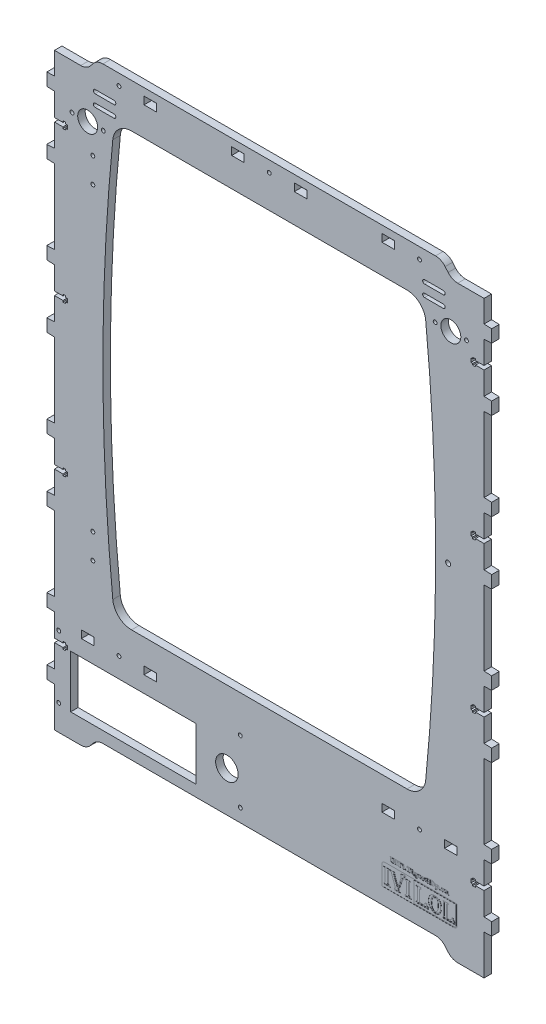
SolidWorks part; units mm, degrees
ref_plane "Спереди" through (0, 0, 0) normal (0, 0, 1) x (1, 0, 0)
ref_plane "Сверху" through (0, 0, 0) normal (0, 1, 0) x (1, 0, 0)
ref_plane "Справа" through (0, 0, 0) normal (1, 0, 0) x (0, 0, -1)
sketch "Эскиз1" plane through (0, 0, 0) normal (0, 0, 1) x (1, 0, 0)
  line L0 (161, 62) -> (177.8027, 62) construction
  line L1 (0, 77) -> (151.5411, 77) construction
  line L2 (132.5, 434) -> (157.5, 434) construction
  line L3 (90, 80.05) -> (100, 80.05)
  line L4 (100, 73.95) -> (90, 73.95)
  line L5 (90, 73.95) -> (90, 80.05)
  line L6 (100, 80.05) -> (100, 73.95)
  line L7 (140, 80.05) -> (150, 80.05)
  line L8 (150, 73.95) -> (140, 73.95)
  line L9 (140, 73.95) -> (140, 80.05)
  line L10 (150, 80.05) -> (150, 73.95)
  line L11 (-110, 445) -> (110, 445)
  line L12 (177.6, 37) -> (162.5, 37) construction
  line L13 (171.5, 92.25) -> (177.6, 92)
  line L14 (177.6, 82) -> (171.5, 81.75)
  line L15 (177.6, 92) -> (177.6, 82)
  line L16 (162.5, 63.55) -> (161, 63.55)
  line L17 (162.5, 64.75) -> (162.5, 63.55)
  line L18 (164.7, 64.75) -> (162.5, 64.75)
  line L19 (164.7, 63.55) -> (164.7, 64.75)
  line L20 (100, 468.05) -> (90, 468.05)
  line L21 (90, 468.05) -> (90, 474.15)
  line L22 (90, 474.15) -> (100, 474.15)
  line L23 (100, 474.15) -> (100, 468.05)
  line L24 (-20, 474.15) -> (-30, 474.15)
  line L25 (20, 474.15) -> (30, 474.15)
  line L26 (20, 474.15) -> (20, 468.05)
  line L27 (20, 468.05) -> (30, 468.05)
  line L32 (171.5, 63.55) -> (164.7, 63.55)
  line L33 (171.5, 81.75) -> (171.5, 63.55)
  line L34 (171.5, 212.25) -> (177.6, 212)
  line L35 (0, 471.1) -> (120, 471.1) construction
  line L36 (-150.5, 0) -> (-171.5, 0)
  line L37 (-140.4433, 6.4279) -> (-142.8396, 3.5721)
  line L38 (-177.6, 42) -> (-171.5, 42.25)
  line L39 (-177.6, 32) -> (-177.6, 42)
  line L40 (-132.7829, 10) -> (132.7829, 10)
  line L41 (140.4433, 6.4279) -> (142.8396, 3.5721)
  line L42 (150.5, 0) -> (171.5, 0)
  line L43 (171.5, 0) -> (171.5, 31.75)
  line L44 (171.5, 31.75) -> (177.6, 32)
  line L45 (177.6, 32) -> (177.6, 42)
  line L46 (177.6, 42) -> (171.5, 42.25)
  line L47 (171.5, 42.25) -> (171.5, 60.45)
  line L48 (171.5, 60.45) -> (164.7, 60.45)
  line L49 (164.7, 60.45) -> (164.7, 59.25)
  line L50 (164.7, 59.25) -> (162.5, 59.25)
  line L51 (162.5, 59.25) -> (162.5, 60.45)
  line L52 (162.5, 60.45) -> (161, 60.45)
  line L53 (161, 60.45) -> (161, 63.55)
  line L54 (-171.5, 31.75) -> (-177.6, 32)
  line L55 (-171.5, 0) -> (-171.5, 31.75)
  line L56 (-171.5, 42.25) -> (-171.5, 60.45)
  line L57 (-162.5, 60.45) -> (-161, 60.45)
  line L58 (-162.5, 59.25) -> (-162.5, 60.45)
  line L59 (-164.7, 59.25) -> (-162.5, 59.25)
  line L60 (177.6, 212) -> (177.6, 202)
  line L61 (-177.6, 442) -> (-171.5, 441.75)
  line L62 (-171.5, 470) -> (-171.5, 452.25)
  line L63 (177.6, 202) -> (171.5, 201.75)
  line L64 (171.5, 201.75) -> (171.5, 183.55)
  line L65 (171.5, 183.55) -> (164.7, 183.55)
  line L66 (164.7, 184.75) -> (162.5, 184.75)
  line L67 (171.5, 180.45) -> (164.7, 180.45)
  line L68 (171.5, 162.25) -> (171.5, 180.45)
  line L69 (177.6, 162) -> (171.5, 162.25)
  line L70 (177.6, 152) -> (177.6, 162)
  line L71 (171.5, 151.75) -> (177.6, 152)
  line L72 (162.5, 183.55) -> (161, 183.55)
  line L73 (162.5, 184.75) -> (162.5, 183.55)
  line L74 (164.7, 183.55) -> (164.7, 184.75)
  line L75 (161, 180.45) -> (161, 183.55)
  line L76 (162.5, 180.45) -> (161, 180.45)
  line L77 (162.5, 179.25) -> (162.5, 180.45)
  line L78 (164.7, 179.25) -> (162.5, 179.25)
  line L79 (164.7, 180.45) -> (164.7, 179.25)
  line L80 (171.5, 332.25) -> (177.6, 332)
  line L81 (177.6, 332) -> (177.6, 322)
  line L82 (177.6, 322) -> (171.5, 321.75)
  line L83 (171.5, 321.75) -> (171.5, 303.55)
  line L84 (171.5, 303.55) -> (164.7, 303.55)
  line L85 (164.7, 304.75) -> (162.5, 304.75)
  line L86 (171.5, 300.45) -> (164.7, 300.45)
  line L87 (171.5, 282.25) -> (171.5, 300.45)
  line L88 (177.6, 282) -> (171.5, 282.25)
  line L89 (177.6, 272) -> (177.6, 282)
  line L90 (171.5, 271.75) -> (177.6, 272)
  line L91 (162.5, 303.55) -> (161, 303.55)
  line L92 (162.5, 304.75) -> (162.5, 303.55)
  line L93 (164.7, 303.55) -> (164.7, 304.75)
  line L94 (161, 300.45) -> (161, 303.55)
  line L95 (162.5, 300.45) -> (161, 300.45)
  line L96 (162.5, 299.25) -> (162.5, 300.45)
  line L97 (164.7, 299.25) -> (162.5, 299.25)
  line L98 (164.7, 300.45) -> (164.7, 299.25)
  line L99 (171.5, 452.25) -> (177.6, 452)
  line L100 (177.6, 452) -> (177.6, 442)
  line L101 (177.6, 442) -> (171.5, 441.75)
  line L102 (171.5, 441.75) -> (171.5, 423.55)
  line L103 (171.5, 423.55) -> (164.7, 423.55)
  line L104 (171.5, 470) -> (150.5, 470)
  line L105 (142.8396, 473.5721) -> (140.4433, 476.4279)
  line L106 (132.7829, 480) -> (-132.7829, 480)
  line L107 (164.7, 424.75) -> (162.5, 424.75)
  line L108 (171.5, 420.45) -> (164.7, 420.45)
  line L109 (171.5, 402.25) -> (171.5, 420.45)
  line L110 (177.6, 402) -> (171.5, 402.25)
  line L111 (177.6, 392) -> (177.6, 402)
  line L112 (171.5, 391.75) -> (177.6, 392)
  line L113 (162.5, 423.55) -> (161, 423.55)
  line L114 (162.5, 424.75) -> (162.5, 423.55)
  line L115 (164.7, 423.55) -> (164.7, 424.75)
  line L116 (161, 420.45) -> (161, 423.55)
  line L117 (162.5, 420.45) -> (161, 420.45)
  line L118 (162.5, 419.25) -> (162.5, 420.45)
  line L119 (164.7, 419.25) -> (162.5, 419.25)
  line L120 (164.7, 420.45) -> (164.7, 419.25)
  line L121 (171.5, 470) -> (171.5, 452.25)
  line L122 (171.5, 391.75) -> (171.5, 332.25)
  line L123 (171.5, 271.75) -> (171.5, 212.25)
  line L124 (-177.6, 452) -> (-177.6, 442)
  line L125 (-171.5, 452.25) -> (-177.6, 452)
  line L126 (-164.7, 420.45) -> (-164.7, 419.25)
  line L127 (-164.7, 419.25) -> (-162.5, 419.25)
  line L128 (-162.5, 419.25) -> (-162.5, 420.45)
  line L129 (-162.5, 420.45) -> (-161, 420.45)
  line L130 (-161, 420.45) -> (-161, 423.55)
  line L131 (-164.7, 423.55) -> (-164.7, 424.75)
  line L132 (-162.5, 424.75) -> (-162.5, 423.55)
  line L133 (-162.5, 423.55) -> (-161, 423.55)
  line L134 (-171.5, 391.75) -> (-177.6, 392)
  line L135 (171.5, 151.75) -> (171.5, 92.25)
  line L136 (-177.6, 392) -> (-177.6, 402)
  line L137 (-177.6, 402) -> (-171.5, 402.25)
  line L138 (-171.5, 402.25) -> (-171.5, 420.45)
  line L139 (-171.5, 420.45) -> (-164.7, 420.45)
  line L140 (-164.7, 424.75) -> (-162.5, 424.75)
  line L141 (-171.5, 423.55) -> (-164.7, 423.55)
  line L142 (-171.5, 441.75) -> (-171.5, 423.55)
  line L143 (-171.5, 391.75) -> (-171.5, 332.25)
  line L144 (-164.7, 300.45) -> (-164.7, 299.25)
  line L145 (-164.7, 60.45) -> (-164.7, 59.25)
  line L146 (-171.5, 60.45) -> (-164.7, 60.45)
  line L147 (-161, 60.45) -> (-161, 63.55)
  line L148 (-164.7, 63.55) -> (-164.7, 64.75)
  line L149 (30, 474.15) -> (30, 468.05)
  line L150 (-30, 474.15) -> (-30, 468.05)
  line L151 (-20, 468.05) -> (-30, 468.05)
  line L152 (-20, 474.15) -> (-20, 468.05)
  line L153 (-100, 474.15) -> (-100, 468.05)
  line L154 (-90, 474.15) -> (-100, 474.15)
  line L155 (-90, 468.05) -> (-90, 474.15)
  line L156 (-100, 468.05) -> (-90, 468.05)
  line L157 (-132.5, 434) -> (-157.5, 434) construction
  line L158 (-142.8396, 473.5721) -> (-140.4433, 476.4279)
  line L159 (-171.5, 470) -> (-150.5, 470)
  line L160 (-164.7, 299.25) -> (-162.5, 299.25)
  line L161 (-162.5, 299.25) -> (-162.5, 300.45)
  line L162 (-162.5, 300.45) -> (-161, 300.45)
  line L163 (-161, 300.45) -> (-161, 303.55)
  line L164 (-164.7, 303.55) -> (-164.7, 304.75)
  line L165 (-162.5, 304.75) -> (-162.5, 303.55)
  line L166 (-162.5, 303.55) -> (-161, 303.55)
  line L167 (-171.5, 271.75) -> (-177.6, 272)
  line L168 (-177.6, 272) -> (-177.6, 282)
  line L169 (-177.6, 282) -> (-171.5, 282.25)
  line L170 (-171.5, 282.25) -> (-171.5, 300.45)
  line L171 (-171.5, 300.45) -> (-164.7, 300.45)
  line L172 (-164.7, 64.75) -> (-162.5, 64.75)
  line L173 (110, 100) -> (-110, 100)
  line L174 (-162.5, 64.75) -> (-162.5, 63.55)
  line L175 (-162.5, 63.55) -> (-161, 63.55)
  line L176 (-171.5, 81.75) -> (-171.5, 63.55)
  line L177 (-171.5, 63.55) -> (-164.7, 63.55)
  line L178 (-177.6, 92) -> (-177.6, 82)
  line L179 (-177.6, 82) -> (-171.5, 81.75)
  line L180 (-171.5, 92.25) -> (-177.6, 92)
  line L181 (-171.5, 151.75) -> (-171.5, 92.25)
  line L182 (161, 422) -> (174.4385, 422) construction
  line L187 (-150, 80.05) -> (-150, 73.95)
  line L188 (-164.7, 304.75) -> (-162.5, 304.75)
  line L189 (-171.5, 303.55) -> (-164.7, 303.55)
  line L190 (-171.5, 321.75) -> (-171.5, 303.55)
  line L191 (-177.6, 322) -> (-171.5, 321.75)
  line L192 (-177.6, 332) -> (-177.6, 322)
  line L193 (-171.5, 332.25) -> (-177.6, 332)
  line L194 (-140, 73.95) -> (-140, 80.05)
  line L195 (-171.5, 271.75) -> (-171.5, 212.25)
  line L196 (-164.7, 180.45) -> (-164.7, 179.25)
  line L197 (-150, 73.95) -> (-140, 73.95)
  line L198 (-140, 80.05) -> (-150, 80.05)
  line L199 (-100, 80.05) -> (-100, 73.95)
  line L200 (-90, 73.95) -> (-90, 80.05)
  line L201 (-164.7, 179.25) -> (-162.5, 179.25)
  line L202 (-162.5, 179.25) -> (-162.5, 180.45)
  line L203 (-162.5, 180.45) -> (-161, 180.45)
  line L204 (-100, 73.95) -> (-90, 73.95)
  line L205 (-90, 80.05) -> (-100, 80.05)
  line L208 (-161, 180.45) -> (-161, 183.55)
  line L209 (-164.7, 183.55) -> (-164.7, 184.75)
  line L210 (-162.5, 184.75) -> (-162.5, 183.55)
  line L211 (-162.5, 183.55) -> (-161, 183.55)
  line L212 (-171.5, 151.75) -> (-177.6, 152)
  line L213 (-177.6, 152) -> (-177.6, 162)
  line L214 (0, 636.9153) -> (0, 0) construction
  line L215 (0, 0) -> (385.9726, 0) construction
  line L216 (-177.6, 162) -> (-171.5, 162.25)
  line L217 (-171.5, 162.25) -> (-171.5, 180.45)
  line L218 (-171.5, 180.45) -> (-164.7, 180.45)
  line L219 (-164.7, 184.75) -> (-162.5, 184.75)
  line L220 (-171.5, 183.55) -> (-164.7, 183.55)
  line L221 (-171.5, 201.75) -> (-171.5, 183.55)
  line L222 (-177.6, 202) -> (-171.5, 201.75)
  line L223 (-177.6, 212) -> (-177.6, 202)
  line L235 (-171.5, 212.25) -> (-177.6, 212)
  arc A0 (124.9258, 431.4905) -> (124.9258, 113.5095) centre (-1467.1553, 272.5) cw
  arc A1 (-142.8396, 3.5721) -> (-150.5, 0) centre (-150.5, 10) cw
  circle A2 centre (157.5, 434) radius 1.55
  circle A3 centre (145, 434) radius 7.95
  circle A4 centre (120, 77) radius 1.55
  circle A5 centre (0, 471.1) radius 1.55
  arc A6 (-132.7829, 10) -> (-140.4433, 6.4279) centre (-132.7829, 0) ccw
  circle A8 centre (-120, 77) radius 1.55
  circle A9 centre (120, 471.1) radius 1.55
  circle A11 centre (132.5, 434) radius 1.55
  arc A13 (-140.4433, 476.4279) -> (-132.7829, 480) centre (-132.7829, 470) cw
  arc A14 (-150.5, 470) -> (-142.8396, 473.5721) centre (-150.5, 480) ccw
  arc A15 (132.7829, 10) -> (140.4433, 6.4279) centre (132.7829, 0) cw
  arc A16 (142.8396, 3.5721) -> (150.5, 0) centre (150.5, 10) ccw
  arc A17 (150.5, 470) -> (142.8396, 473.5721) centre (150.5, 480) cw
  arc A18 (140.4433, 476.4279) -> (132.7829, 480) centre (132.7829, 470) ccw
  circle A19 centre (-132.5, 434) radius 1.55
  circle A20 centre (-120, 471.1) radius 1.55
  circle A21 centre (-145, 434) radius 7.95
  arc A22 (110, 100) -> (124.9258, 113.5095) centre (110, 115) ccw
  circle A23 centre (-157.5, 434) radius 1.55
  arc A24 (110, 445) -> (124.9258, 431.4905) centre (110, 430) cw
  arc A25 (-110, 100) -> (-124.9258, 113.5095) centre (-110, 115) cw
  arc A26 (-110, 445) -> (-124.9258, 431.4905) centre (-110, 430) ccw
  arc A27 (-124.9258, 431.4905) -> (-124.9258, 113.5095) centre (1467.1553, 272.5) ccw
  point P50 (90, 77)
  point P52 (140, 77)
  point P58 (145, 434)
  point P61 (90, 471.1)
  point P90 (0, 10)
  dimension "D4" = 10
  dimension "D12" = 3.1
  dimension "D13" = 15.9
  dimension "D14" = 4
  dimension "D15" = 240
  dimension "D17" = 10
  dimension "D34" = 36
  dimension "D22" = 15
  dimension "D20" = 1600
  dimension "D19" = 290
  dimension "D1" = 171.5
  dimension "D2" = 480
  dimension "D3" = 20
  dimension "D5" = 50
  dimension "D6" = 21
  dimension "D7" = 58
  dimension "D8" = 6.1
  dimension "D9" = 77
  dimension "D10" = 180
  dimension "D11" = 6.1
  dimension "D16" = 10
  dimension "D21" = 35
  dimension "D23" = 100
  dimension "D24" = 220
  dimension "D25" = 10
  dimension "D26" = 25
  dimension "D27" = 10.5
  dimension "D28" = 10.5
  dimension "D29" = 3.1
  dimension "D30" = 2.2
  dimension "D31" = 1.5
  dimension "D32" = 5.5
  dimension "D33" = 25
  dimension "D35" = 8.9
  dimension "D36" = 10
  dimension "D37" = 50
  dimension "D38" = 40
  dimension "D43" = 120
  dimension "D18" = 40
extrude "Бобышка-Вытянуть1" add sketch "Эскиз1" against normal blind 6
sketch "Эскиз2" plane through (0, 0, 0) normal (0, 0, 1) x (1, 0, 0)
  line L1 (-158.6, 61) -> (-58.6, 61)
  line L2 (-158.6, 61) -> (-158.6, 19)
  line L3 (-158.6, 19) -> (-58.6, 19)
  line L4 (-58.6, 61) -> (-58.6, 19)
  line L5 (-168.1, 70.5) -> (-23.1, 70.5) construction
  line L6 (-158.6, 40) -> (-58.6, 40) construction
  line L7 (-108.6, 61) -> (-108.6, 19) construction
  line L8 (-168.1, 70.5) -> (-168.1, 20.5) construction
  line L9 (-171.5, 0) -> (-150.5, 0) construction
  line L10 (-177.6, 162) -> (-177.6, 152) construction
  line L11 (-168.1, 20.5) -> (-23.1, 20.5) construction
  line L12 (-23.1, 70.5) -> (-23.1, 20.5) construction
  circle A0 centre (-33.8, 42.5) radius 9
  circle A1 centre (-168.1, 70.5) radius 1.55
  circle A2 centre (-23.1, 70.5) radius 1.55
  circle A3 centre (-23.1, 20.5) radius 1.55
  circle A4 centre (-168.1, 20.5) radius 1.55
  dimension "D5" = 74.8
  dimension "D6" = 2.5
  dimension "D7" = 18
  dimension "D8" = 3.1
  dimension "D1" = 69
  dimension "D2" = 100
  dimension "D3" = 42
  dimension "D4" = 40
  dimension "D9" = 59.5
  dimension "D10" = 30.5
  dimension "D11" = 50
  dimension "D12" = 145
extrude "Вырез-Вытянуть1" cut sketch "Эскиз2" against normal through all
sketch "Эскиз3" plane through (0, 0, 0) normal (0, 0, 1) x (1, 0, 0)
  line L0 (-171.5, 453) -> (-79.9387, 453) construction
  line L1 (-171.5, 470) -> (-171.5, 452.25) construction
  line L2 (-139, 457.7) -> (-124, 457.7) construction
  line L3 (-139, 459.2) -> (-124, 459.2)
  line L4 (-139, 456.2) -> (-124, 456.2)
  line L5 (132.7829, 480) -> (-132.7829, 480) construction
  line L6 (-139, 448.3) -> (-124, 448.3) construction
  line L7 (-139, 446.8) -> (-124, 446.8)
  line L8 (-139, 449.8) -> (-124, 449.8)
  line L9 (0, 0) -> (0, 504.2081) construction
  line L10 (139, 448.3) -> (124, 448.3) construction
  line L11 (139, 446.8) -> (124, 446.8)
  line L12 (139, 449.8) -> (124, 449.8)
  line L13 (139, 457.7) -> (124, 457.7) construction
  line L14 (139, 459.2) -> (124, 459.2)
  line L15 (139, 456.2) -> (124, 456.2)
  arc A0 (-139, 459.2) -> (-139, 456.2) centre (-139, 457.7) ccw
  arc A1 (-124, 456.2) -> (-124, 459.2) centre (-124, 457.7) ccw
  arc A2 (-139, 446.8) -> (-139, 449.8) centre (-139, 448.3) cw
  arc A3 (-124, 449.8) -> (-124, 446.8) centre (-124, 448.3) cw
  arc A4 (139, 446.8) -> (139, 449.8) centre (139, 448.3) ccw
  arc A5 (124, 449.8) -> (124, 446.8) centre (124, 448.3) ccw
  arc A6 (139, 459.2) -> (139, 456.2) centre (139, 457.7) cw
  arc A7 (124, 456.2) -> (124, 459.2) centre (124, 457.7) cw
  point P6 (-131.5, 457.7)
  point P15 (-131.5, 448.3)
  point P25 (131.5, 448.3)
  point P32 (131.5, 457.7)
  dimension "D1" = 1.5
  dimension "D2" = 9.4
  dimension "D3" = 27
  dimension "D4" = 15
  dimension "D5" = 40
extrude "Вырез-Вытянуть2" cut sketch "Эскиз3" against normal through all
sketch "Эскиз5" plane through (0, 0, 0) normal (0, 0, 1) x (1, 0, 0)
  line L0 (149.2685, 39.7304) -> (149.2685, 24.9225)
  line L1 (115.4817, 23.5765) -> (115.4817, 39.7304)
  line L2 (115.4817, 39.7304) -> (149.2685, 39.7304)
  line L3 (150, 40.4035) -> (150, 24.9225)
  line L4 (147.8049, 22.9034) -> (90, 22.9034)
  line L5 (90, 22.9034) -> (90, 38.3844)
  line L6 (92.1951, 40.4035) -> (150, 40.4035)
  line L7 (91.3331, 37.2131) -> (95.5435, 37.2131)
  line L8 (95.5435, 37.2131) -> (94.3514, 36.0166)
  line L9 (94.3514, 36.0166) -> (94.3514, 26.8641)
  line L10 (94.3514, 26.8641) -> (95.4706, 25.9315)
  line L11 (95.4706, 25.9315) -> (91.3331, 25.9315)
  line L12 (91.3331, 25.9315) -> (92.5677, 26.9421)
  line L13 (92.5677, 26.9421) -> (92.5677, 36.1125)
  line L14 (92.5677, 36.1125) -> (91.3331, 37.2131)
  line L15 (95.9499, 36.7123) -> (95.0429, 35.8217)
  line L16 (95.0429, 35.8217) -> (95.0429, 26.8612)
  line L17 (95.0429, 26.8612) -> (96.5354, 25.2118)
  line L18 (96.5354, 25.2118) -> (91.9277, 25.2118)
  line L19 (91.9277, 25.2118) -> (91.7062, 25.4456)
  line L20 (91.7062, 25.4456) -> (96.0106, 25.4456)
  line L21 (96.0106, 25.4456) -> (94.8064, 26.7742)
  line L22 (94.8064, 26.7742) -> (94.8064, 35.9027)
  line L23 (94.8064, 35.9027) -> (95.7982, 36.8862)
  line L24 (95.7982, 36.8862) -> (95.9499, 36.7123)
  line L25 (108.7569, 39.99) -> (108.857, 39.8941)
  line L26 (105.1867, 33.5635) -> (102.5901, 26.8461)
  line L27 (102.5901, 26.8461) -> (103.6488, 25.9315)
  line L28 (103.6488, 25.9315) -> (99.5506, 25.9315)
  line L29 (99.5506, 25.9315) -> (100.7245, 26.8881)
  line L30 (100.7245, 26.8881) -> (97.4727, 36.0526)
  line L31 (97.4727, 36.0526) -> (96.1016, 37.2131)
  line L32 (96.1016, 37.2131) -> (100.5122, 37.2131)
  line L33 (100.5122, 37.2131) -> (99.2563, 35.9716)
  line L34 (99.2563, 35.9716) -> (102.1896, 27.7158)
  line L35 (102.1896, 27.7158) -> (102.5355, 28.5315)
  line L36 (102.5355, 28.5315) -> (99.9146, 35.8486)
  line L37 (99.9146, 35.8486) -> (100.8216, 36.7393)
  line L38 (100.8216, 36.7393) -> (100.9823, 36.5714)
  line L39 (100.9823, 36.5714) -> (100.1906, 35.7947)
  line L40 (100.1906, 35.7947) -> (102.6538, 28.8403)
  line L41 (102.6538, 28.8403) -> (104.5315, 33.8184)
  line L42 (104.7134, 38.4607) -> (104.8833, 38.4966)
  line L43 (109.2392, 39.4533) -> (109.3181, 39.2524)
  line L44 (105.8176, 33.2726) -> (103.309, 26.8072)
  line L45 (103.309, 26.8072) -> (104.6952, 25.2118)
  line L46 (104.6952, 25.2118) -> (100.1118, 25.2118)
  line L47 (100.1118, 25.2118) -> (99.9146, 25.4456)
  line L48 (99.9146, 25.4456) -> (104.1735, 25.4456)
  line L49 (104.1735, 25.4456) -> (103.0511, 26.7471)
  line L50 (103.0511, 26.7471) -> (105.6022, 33.3326)
  line L51 (105.6022, 33.3326) -> (106.0815, 34.5832)
  line L52 (108.1745, 37.2131) -> (112.3849, 37.2131)
  line L53 (112.3849, 37.2131) -> (111.1928, 36.0166)
  line L54 (111.1928, 36.0166) -> (111.1928, 26.8641)
  line L55 (111.1928, 26.8641) -> (112.3121, 25.9315)
  line L56 (112.3121, 25.9315) -> (108.1745, 25.9315)
  line L57 (108.1745, 25.9315) -> (109.4092, 26.9421)
  line L58 (109.4092, 26.9421) -> (109.4092, 36.1125)
  line L59 (109.4092, 36.1125) -> (108.1745, 37.2131)
  line L60 (112.7914, 36.7123) -> (111.8844, 35.8217)
  line L61 (111.8844, 35.8217) -> (111.8844, 26.8612)
  line L62 (111.8844, 26.8612) -> (113.3768, 25.2118)
  line L63 (113.3768, 25.2118) -> (108.7691, 25.2118)
  line L64 (108.7691, 25.2118) -> (108.5477, 25.4456)
  line L65 (108.5477, 25.4456) -> (112.852, 25.4456)
  line L66 (112.852, 25.4456) -> (111.6478, 26.7742)
  line L67 (111.6478, 26.7742) -> (111.6478, 35.9027)
  line L68 (111.6478, 35.9027) -> (112.6397, 36.8862)
  line L69 (112.6397, 36.8862) -> (112.7914, 36.7123)
  line L70 (117.1857, 37.2131) -> (121.4294, 37.2131)
  line L71 (121.4294, 37.2131) -> (120.1766, 36.0076)
  line L72 (120.1766, 36.0076) -> (120.1766, 26.6062)
  line L73 (120.1766, 26.6062) -> (120.2494, 26.6062)
  line L74 (120.2494, 26.6062) -> (120.5679, 26.5792)
  line L75 (120.5679, 26.5792) -> (120.6498, 26.5792)
  line L76 (120.6498, 26.5792) -> (120.6498, 35.9206)
  line L77 (120.6498, 35.9206) -> (121.6053, 36.8803)
  line L78 (121.6053, 36.8803) -> (121.7297, 36.6853)
  line L79 (121.7297, 36.6853) -> (120.8682, 35.8127)
  line L80 (120.8682, 35.8127) -> (120.8682, 26.5792)
  line L81 (126.4587, 25.9315) -> (117.1857, 25.9315)
  line L82 (117.1857, 25.9315) -> (118.4112, 26.9211)
  line L83 (118.4112, 26.9211) -> (118.4112, 36.0946)
  line L84 (118.4112, 36.0946) -> (117.1857, 37.2131)
  line L85 (127.3415, 26.0004) -> (126.9411, 25.2118)
  line L86 (126.9411, 25.2118) -> (117.6619, 25.2118)
  line L87 (117.6619, 25.2118) -> (117.4405, 25.4456)
  line L88 (117.4405, 25.4456) -> (126.844, 25.4456)
  line L89 (126.844, 25.4456) -> (127.1019, 26.0004)
  line L90 (125.5366, 28.6455) -> (125.5002, 28.7414)
  line L91 (125.5002, 28.7414) -> (125.7854, 28.6364)
  line L92 (125.7854, 28.6364) -> (125.849, 28.4865)
  line L93 (127.2687, 26.0875) -> (127.3415, 26.0004)
  line L94 (134.0423, 35.2519) -> (133.8906, 35.3388)
  line L95 (131.4366, 26.8551) -> (131.3577, 26.7682)
  line L96 (129.6256, 26.1084) -> (129.6256, 26.1534)
  line L97 (134.9735, 36.7813) -> (134.9735, 36.8803)
  line L98 (138.5044, 37.2131) -> (142.7481, 37.2131)
  line L99 (142.7481, 37.2131) -> (141.4953, 36.0076)
  line L100 (141.4953, 36.0076) -> (141.4953, 26.6062)
  line L101 (141.4953, 26.6062) -> (141.5681, 26.6062)
  line L102 (141.5681, 26.6062) -> (141.8866, 26.5792)
  line L103 (141.8866, 26.5792) -> (141.9685, 26.5792)
  line L104 (141.9685, 26.5792) -> (141.9685, 35.9206)
  line L105 (141.9685, 35.9206) -> (142.924, 36.8803)
  line L106 (142.924, 36.8803) -> (143.0484, 36.6853)
  line L107 (143.0484, 36.6853) -> (142.1869, 35.8127)
  line L108 (142.1869, 35.8127) -> (142.1869, 26.5792)
  line L109 (147.7774, 25.9315) -> (138.5044, 25.9315)
  line L110 (138.5044, 25.9315) -> (139.7299, 26.9211)
  line L111 (139.7299, 26.9211) -> (139.7299, 36.0946)
  line L112 (139.7299, 36.0946) -> (138.5044, 37.2131)
  line L113 (148.6602, 26.0004) -> (148.2598, 25.2118)
  line L114 (148.2598, 25.2118) -> (138.9806, 25.2118)
  line L115 (138.9806, 25.2118) -> (138.7592, 25.4456)
  line L116 (138.7592, 25.4456) -> (148.1627, 25.4456)
  line L117 (148.1627, 25.4456) -> (148.4206, 26.0004)
  line L118 (146.8553, 28.6455) -> (146.8189, 28.7414)
  line L119 (146.8189, 28.7414) -> (147.1041, 28.6364)
  line L120 (147.1041, 28.6364) -> (147.1677, 28.4865)
  line L121 (148.5874, 26.0875) -> (148.6602, 26.0004)
  spline S0 degree 3 poles (149.2685, 24.9225) (149.2685, 24.1828) (148.6096, 23.5765) (147.8049, 23.5765) knots 0.166667 0.166667 0.166667 0.166667 0.333333 0.333333 0.333333 0.333333
  spline S1 degree 3 poles (147.8049, 23.5765) (136.6137, 23.5765) (126.673, 23.5765) (115.4817, 23.5765) knots 0.333333 0.333333 0.333333 0.333333 0.5 0.5 0.5 0.5
  spline S2 degree 3 poles (150, 24.9225) (150, 23.8127) (149.0115, 22.9034) (147.8049, 22.9034) knots 0.142857 0.142857 0.142857 0.142857 0.285714 0.285714 0.285714 0.285714
  spline S3 degree 3 poles (90, 38.3844) (90, 39.4947) (90.9878, 40.4035) (92.1951, 40.4035) knots 0.571429 0.571429 0.571429 0.571429 0.714286 0.714286 0.714286 0.714286
  spline S4 degree 3 poles (108.857, 39.8941) (108.0805, 39.1534) (107.4465, 38.3617) (106.9551, 37.519) knots 0.041667 0.041667 0.041667 0.041667 0.083333 0.083333 0.083333 0.083333
  spline S5 degree 3 poles (106.9551, 37.519) (106.4606, 36.6733) (105.8722, 35.3569) (105.1867, 33.5635) knots 0.083333 0.083333 0.083333 0.083333 0.125 0.125 0.125 0.125
  spline S6 degree 3 poles (104.5315, 33.8184) (105.0926, 35.2938) (105.3747, 36.3285) (105.3747, 36.9223) knots 0.791667 0.791667 0.791667 0.791667 0.833333 0.833333 0.833333 0.833333
  spline S7 degree 3 poles (105.3747, 36.9223) (105.3747, 37.519) (105.1533, 38.0318) (104.7134, 38.4607) knots 0.833333 0.833333 0.833333 0.833333 0.875 0.875 0.875 0.875
  spline S8 degree 3 poles (104.8833, 38.4966) (106.6063, 38.8235) (107.8985, 39.3213) (108.7569, 39.99) knots 0.916667 0.916667 0.916667 0.916667 1 1 1 1
  spline S9 degree 3 poles (109.3181, 39.2524) (108.1867, 38.3767) (107.0188, 36.3855) (105.8176, 33.2726) knots 0.076923 0.076923 0.076923 0.076923 0.153846 0.153846 0.153846 0.153846
  spline S10 degree 3 poles (106.0815, 34.5832) (106.5092, 35.6598) (107.0127, 36.6463) (107.5921, 37.54) knots 0.769231 0.769231 0.769231 0.769231 0.846154 0.846154 0.846154 0.846154
  spline S11 degree 3 poles (107.5921, 37.54) (108.1745, 38.4337) (108.7236, 39.0724) (109.2392, 39.4533) knots 0.846154 0.846154 0.846154 0.846154 1 1 1 1
  spline S12 degree 3 poles (120.8682, 26.5792) (121.1352, 26.5552) (121.39, 26.5433) (121.6326, 26.5433) knots 0.55 0.55 0.55 0.55 0.6 0.6 0.6 0.6
  spline S13 degree 3 poles (121.6326, 26.5433) (122.576, 26.5433) (123.2859, 26.7502) (123.7712, 27.164) knots 0.6 0.6 0.6 0.6 0.65 0.65 0.65 0.65
  spline S14 degree 3 poles (123.7712, 27.164) (124.2534, 27.5778) (124.5781, 28.2586) (124.7418, 29.2062) knots 0.65 0.65 0.65 0.65 0.7 0.7 0.7 0.7
  spline S15 degree 3 poles (124.7418, 29.2062) (125.3, 27.6079) (125.8702, 26.5162) (126.4587, 25.9315) knots 0.7 0.7 0.7 0.7 0.75 0.75 0.75 0.75
  spline S16 degree 3 poles (127.1019, 26.0004) (126.4496, 26.7921) (125.9279, 27.6738) (125.5366, 28.6455) knots 0.416667 0.416667 0.416667 0.416667 0.5 0.5 0.5 0.5
  spline S17 degree 3 poles (125.849, 28.4865) (126.2464, 27.6199) (126.7196, 26.8191) (127.2687, 26.0875) knots 0.75 0.75 0.75 0.75 0.833333 0.833333 0.833333 0.833333
  spline S18 degree 3 poles (133.8906, 35.3388) (133.3233, 35.6537) (132.8016, 35.8096) (132.3284, 35.8096) knots 0.1 0.1 0.1 0.1 0.2 0.2 0.2 0.2
  spline S19 degree 3 poles (132.3284, 35.8096) (130.7722, 35.8096) (129.9926, 34.2952) (129.9926, 31.2634) knots 0.2 0.2 0.2 0.2 0.3 0.3 0.3 0.3
  spline S20 degree 3 poles (129.9926, 31.2634) (129.9926, 29.0443) (130.475, 27.5749) (131.4366, 26.8551) knots 0.3 0.3 0.3 0.3 0.4 0.4 0.4 0.4
  spline S21 degree 3 poles (131.3577, 26.7682) (130.7662, 27.182) (130.3476, 27.7278) (130.0958, 28.4056) knots 0.5 0.5 0.5 0.5 0.6 0.6 0.6 0.6
  spline S22 degree 3 poles (130.0958, 28.4056) (129.844, 29.0803) (129.7197, 29.998) (129.7197, 31.1495) knots 0.6 0.6 0.6 0.6 0.7 0.7 0.7 0.7
  spline S23 degree 3 poles (129.7197, 31.1495) (129.7197, 34.4002) (130.5842, 36.0256) (132.3102, 36.0256) knots 0.7 0.7 0.7 0.7 0.8 0.8 0.8 0.8
  spline S24 degree 3 poles (132.3102, 36.0256) (133.0988, 36.0256) (133.6752, 35.7677) (134.0423, 35.2519) knots 0.8 0.8 0.8 0.8 1 1 1 1
  spline S25 degree 3 poles (132.1372, 37.3211) (133.5812, 37.3211) (134.7339, 36.7813) (135.5953, 35.7048) knots 0 0 0 0 0.111111 0.111111 0.111111 0.111111
  spline S26 degree 3 poles (135.5953, 35.7048) (136.4598, 34.6282) (136.8906, 33.1857) (136.8906, 31.3834) knots 0.111111 0.111111 0.111111 0.111111 0.222222 0.222222 0.222222 0.222222
  spline S27 degree 3 poles (136.8906, 31.3834) (136.8906, 29.68) (136.4659, 28.3216) (135.6136, 27.3079) knots 0.222222 0.222222 0.222222 0.222222 0.333333 0.333333 0.333333 0.333333
  spline S28 degree 3 poles (135.6136, 27.3079) (134.7611, 26.2944) (133.6176, 25.7875) (132.1828, 25.7875) knots 0.333333 0.333333 0.333333 0.333333 0.444444 0.444444 0.444444 0.444444
  spline S29 degree 3 poles (132.1828, 25.7875) (131.0482, 25.7875) (130.0412, 26.1444) (129.1554, 26.8581) knots 0.444444 0.444444 0.444444 0.444444 0.555556 0.555556 0.555556 0.555556
  spline S30 degree 3 poles (129.1554, 26.8581) (127.8572, 27.9137) (127.208, 29.4731) (127.208, 31.5423) knots 0.555556 0.555556 0.555556 0.555556 0.666667 0.666667 0.666667 0.666667
  spline S31 degree 3 poles (127.208, 31.5423) (127.208, 33.3087) (127.6539, 34.7151) (128.5427, 35.7587) knots 0.666667 0.666667 0.666667 0.666667 0.777778 0.777778 0.777778 0.777778
  spline S32 degree 3 poles (128.5427, 35.7587) (129.4314, 36.7993) (130.6327, 37.3211) (132.1372, 37.3211) knots 0.777778 0.777778 0.777778 0.777778 1 1 1 1
  spline S33 degree 3 poles (132.1372, 36.5654) (130.1261, 36.5654) (129.1191, 34.8291) (129.1191, 31.3564) knots 0 0 0 0 0.142857 0.142857 0.142857 0.142857
  spline S34 degree 3 poles (129.1191, 31.3564) (129.1191, 28.1476) (130.111, 26.5433) (132.0948, 26.5433) knots 0.142857 0.142857 0.142857 0.142857 0.285714 0.285714 0.285714 0.285714
  spline S35 degree 3 poles (132.0948, 26.5433) (133.0169, 26.5433) (133.7207, 26.9691) (134.203, 27.8178) knots 0.285714 0.285714 0.285714 0.285714 0.428571 0.428571 0.428571 0.428571
  spline S36 degree 3 poles (134.203, 27.8178) (134.6853, 28.6694) (134.925, 29.914) (134.925, 31.5513) knots 0.428571 0.428571 0.428571 0.428571 0.571429 0.571429 0.571429 0.571429
  spline S37 degree 3 poles (134.925, 31.5513) (134.925, 33.4016) (134.6914, 34.6941) (134.2273, 35.4258) knots 0.571429 0.571429 0.571429 0.571429 0.714286 0.714286 0.714286 0.714286
  spline S38 degree 3 poles (134.2273, 35.4258) (133.7389, 36.1845) (133.0442, 36.5654) (132.1372, 36.5654) knots 0.714286 0.714286 0.714286 0.714286 1 1 1 1
  spline S39 degree 3 poles (134.9735, 36.8803) (135.8228, 36.4754) (136.4963, 35.7827) (136.9876, 34.805) knots 0 0 0 0 0.076923 0.076923 0.076923 0.076923
  spline S40 degree 3 poles (136.9876, 34.805) (137.4821, 33.8274) (137.7278, 32.6969) (137.7278, 31.4134) knots 0.076923 0.076923 0.076923 0.076923 0.153846 0.153846 0.153846 0.153846
  spline S41 degree 3 poles (137.7278, 31.4134) (137.7278, 29.5271) (137.2424, 28.0037) (136.2748, 26.8431) knots 0.153846 0.153846 0.153846 0.153846 0.230769 0.230769 0.230769 0.230769
  spline S42 degree 3 poles (136.2748, 26.8431) (135.3041, 25.6826) (134.0301, 25.1038) (132.4528, 25.1038) knots 0.230769 0.230769 0.230769 0.230769 0.307692 0.307692 0.307692 0.307692
  spline S43 degree 3 poles (132.4528, 25.1038) (131.4457, 25.1038) (130.5023, 25.4397) (129.6256, 26.1084) knots 0.307692 0.307692 0.307692 0.307692 0.384615 0.384615 0.384615 0.384615
  spline S44 degree 3 poles (129.6256, 26.1534) (130.3597, 25.6226) (131.2818, 25.3557) (132.3921, 25.3557) knots 0.461538 0.461538 0.461538 0.461538 0.538462 0.538462 0.538462 0.538462
  spline S45 degree 3 poles (132.3921, 25.3557) (133.8814, 25.3557) (135.1039, 25.9105) (136.0594, 27.017) knots 0.538462 0.538462 0.538462 0.538462 0.615385 0.615385 0.615385 0.615385
  spline S46 degree 3 poles (136.0594, 27.017) (137.0149, 28.1237) (137.4912, 29.5391) (137.4912, 31.2634) knots 0.615385 0.615385 0.615385 0.615385 0.692308 0.692308 0.692308 0.692308
  spline S47 degree 3 poles (137.4912, 31.2634) (137.4912, 32.5439) (137.2728, 33.6685) (136.836, 34.6282) knots 0.692308 0.692308 0.692308 0.692308 0.769231 0.769231 0.769231 0.769231
  spline S48 degree 3 poles (136.836, 34.6282) (136.3992, 35.5907) (135.7773, 36.3075) (134.9735, 36.7813) knots 0.769231 0.769231 0.769231 0.769231 0.846154 0.846154 0.846154 0.846154
  spline S49 degree 3 poles (142.1869, 26.5792) (142.4539, 26.5552) (142.7087, 26.5433) (142.9513, 26.5433) knots 0.55 0.55 0.55 0.55 0.6 0.6 0.6 0.6
  spline S50 degree 3 poles (142.9513, 26.5433) (143.8947, 26.5433) (144.6046, 26.7502) (145.0899, 27.164) knots 0.6 0.6 0.6 0.6 0.65 0.65 0.65 0.65
  spline S51 degree 3 poles (145.0899, 27.164) (145.5722, 27.5778) (145.8968, 28.2586) (146.0605, 29.2062) knots 0.65 0.65 0.65 0.65 0.7 0.7 0.7 0.7
  spline S52 degree 3 poles (146.0605, 29.2062) (146.6187, 27.6079) (147.1889, 26.5162) (147.7774, 25.9315) knots 0.7 0.7 0.7 0.7 0.75 0.75 0.75 0.75
  spline S53 degree 3 poles (148.4206, 26.0004) (147.7684, 26.7921) (147.2466, 27.6738) (146.8553, 28.6455) knots 0.416667 0.416667 0.416667 0.416667 0.5 0.5 0.5 0.5
  spline S54 degree 3 poles (147.1677, 28.4865) (147.5651, 27.6199) (148.0383, 26.8191) (148.5874, 26.0875) knots 0.75 0.75 0.75 0.75 0.833333 0.833333 0.833333 0.833333
extrude "Вырез-Вытянуть3" cut sketch "Эскиз5" against normal blind 0.1 contours S3 L5 L4 S2 L3 L6 L68 L69 L60 L61 L62 L63 L64 L65 L66 L67 L58 L59 L52 L53 L54 L55 L56 L57 L23 L24 L15 L16 L17 L18 L19 L20 L21 L22 L13 L14 L7 L8 L9 L10 L11 L12 S0 S1 L1 L2 | S15 S14 S13 S12 L80 L79 L78 L77 L76 L75 L74 L73 L72 L71 L70 L84 L83 L82 L81 | S32 S31 S30 S29 S28 S27 S26 S25 S38 S37 S36 S35 S34 S33 | S24 S23 S22 S21 L95 S20 S19 S18 L94 | S54 L120 L119 L118 S53 L117 L116 L115 L114 L113 L121 | S16 L90 L91 L92 S17 L93 L85 L86 L87 L88 L89 | S43 L96 S44 S45 S46 S47 S48 L97 S39 S40 S41 S42 | L111 L112 L98 L99 L100 L101 L102 L103 L104 L105 L106 L107 L108 S49 S50 S51 S52 L109 L110
sketch "Эскиз6" plane through (0, 0, 0) normal (0, 0, 1) x (1, 0, 0)
  text T0 "UlTi.Tiger3Dp.ru" font "Clarendon Blk BT" height 3.5
extrude "Вырез-Вытянуть4" cut sketch "Эскиз6" against normal blind 0.1
sketch "Эскиз7" plane through (0, 0, 0) normal (0, 0, 1) x (1, 0, 0)
  line L0 (-132.8447, 272.5) -> (270.1401, 272.5) construction
  line L1 (-132.8447, 272.5) -> (-132.8447, 502.7415) construction
  line L2 (-140.8447, 412.5) -> (-140.8447, 392.5) construction
  line L3 (-140.8447, 132.5) -> (-140.8447, 152.5) construction
  arc A0 (-124.9258, 431.4905) -> (-124.9258, 113.5095) centre (1467.1553, 272.5) ccw construction
  circle A1 centre (-140.8447, 412.5) radius 1.55
  circle A2 centre (-140.8447, 392.5) radius 1.55
  circle A3 centre (-140.8447, 152.5) radius 1.55
  circle A4 centre (-140.8447, 132.5) radius 1.55
  point P10 (-140.8447, 402.5)
  dimension "D2" = 3.1
  dimension "D1" = 8
  dimension "D3" = 20
  dimension "D4" = 130
extrude "Вырез-Вытянуть5" cut sketch "Эскиз7" against normal through all
sketch "Эскиз8" plane through (0, 0, 0) normal (0, 0, 1) x (1, 0, 0)
  line L0 (-132.8447, 272.5) -> (253.5834, 272.5) construction
  line L1 (132.8447, 272.5) -> (132.8447, 376.1737) construction
  arc A0 (-124.9258, 431.4905) -> (-124.9258, 113.5095) centre (1467.1553, 272.5) ccw construction
  arc A1 (124.9258, 113.5095) -> (124.9258, 431.4905) centre (-1467.1553, 272.5) ccw construction
  circle A2 centre (142.8447, 272.5) radius 2
  dimension "D1" = 4
  dimension "D2" = 10
extrude "Вырез-Вытянуть6" cut sketch "Эскиз8" against normal through all
